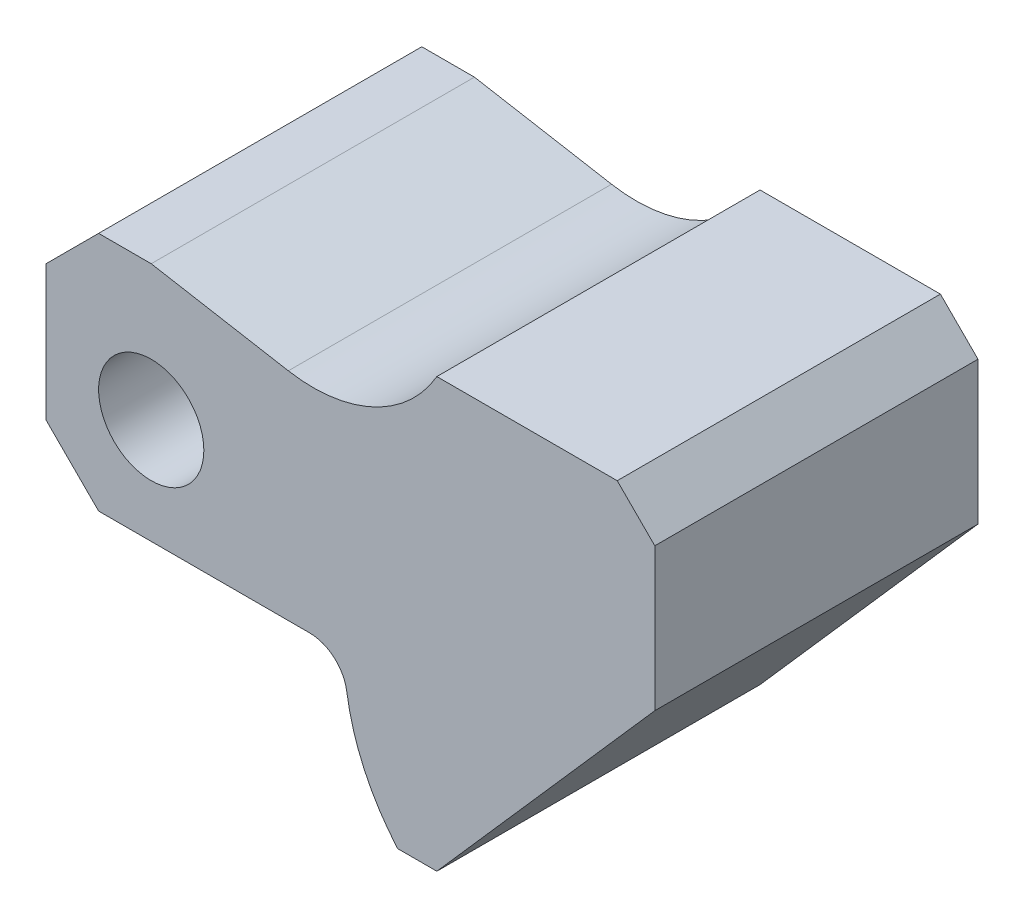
SolidWorks part; units mm, degrees
ref_plane "前视基准面" through (0, 0, 0) normal (0, 0, 1) x (1, 0, 0)
ref_plane "上视基准面" through (0, 0, 0) normal (0, 1, 0) x (1, 0, 0)
ref_plane "右视基准面" through (0, 0, 0) normal (1, 0, 0) x (0, 0, -1)
other "Configuration Table"
sketch "草图1" plane through (0, 0, 0) normal (0, 0, 1) x (1, 0, 0)
  line L0 (21.0666, -14) -> (-7, -14)
  line L1 (-7, -14) -> (-14, -7)
  line L2 (-14, -7) -> (-14, 11)
  line L3 (-14, 11) -> (-7, 18)
  line L4 (-7, 18) -> (0, 18)
  line L5 (38, 24) -> (62, 24)
  line L6 (62, 24) -> (67, 19)
  line L7 (67, 19) -> (67, 0)
  line L8 (67, 0) -> (38, -33)
  line L9 (38, -33) -> (32.7881, -33)
  line L10 (0, 18) -> (18.2431, 14.7833)
  circle A0 centre (0, 0) radius 7
  arc A1 (32.7881, -33) -> (26.0123, -18.2647) centre (54.697, -14) cw
  arc A2 (26.0123, -18.2647) -> (21.0666, -14) centre (21.0666, -19) ccw
  arc A3 (38, 24) -> (18.2431, 14.7833) centre (21.5424, 33.4946) cw
extrude "凸台-拉伸1" add sketch "草图1" along normal blind 43
equation "\"a\"= 81"
equation "\"b\"= 57"
equation "\"c\"= 43"
equation "\"D9@草图1\"=\"a\""
equation "\"D14@草图1\"=\"b\""
equation "\"D1@凸台-拉伸1\"=\"c\""
